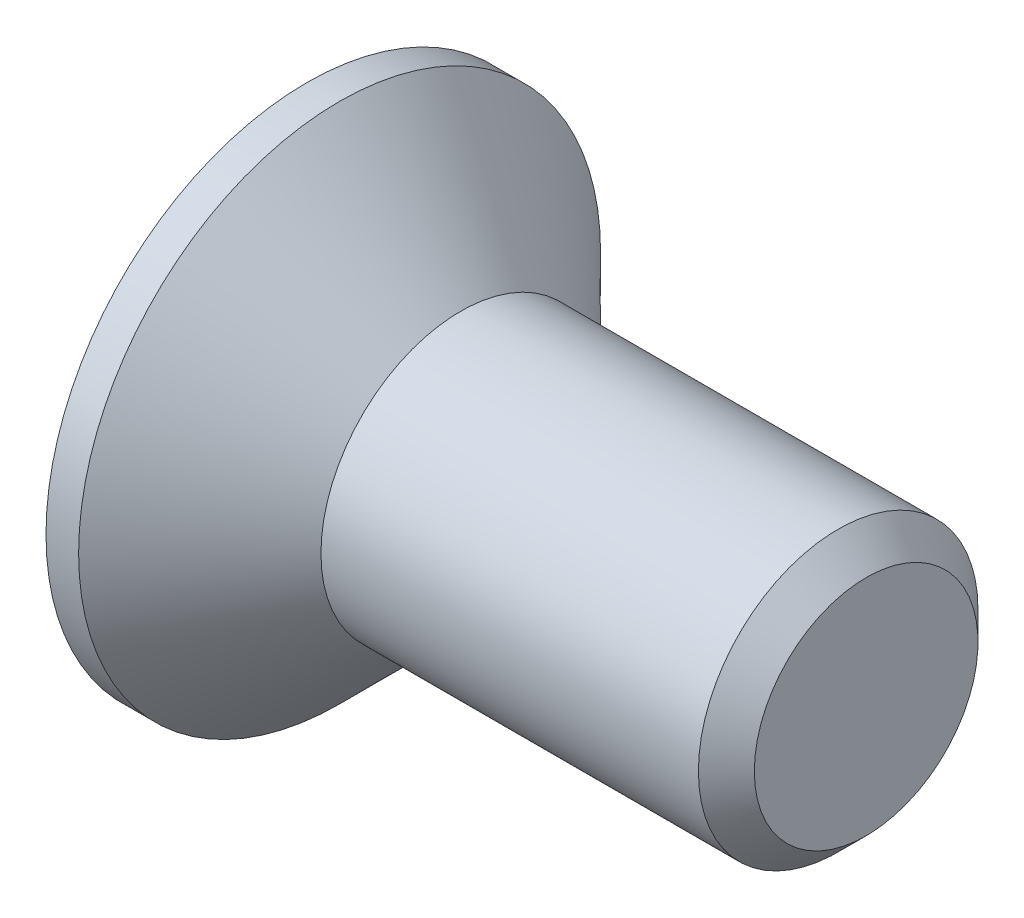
SolidWorks part; units mm, degrees
ref_plane "Front Plane" through (0, 0, 0) normal (0, 0, 1) x (1, 0, 0)
ref_plane "Top Plane" through (0, 0, 0) normal (0, 1, 0) x (1, 0, 0)
ref_plane "Right Plane" through (0, 0, 0) normal (1, 0, 0) x (0, 0, -1)
sketch "Sketch1" plane through (0, 0, 0) normal (0, 0, 1) x (1, 0, 0)
  line L1 (-1.65, 2.8) -> (-1.65, 0)
  line L2 (-1.65, 0) -> (4.35, 0)
  line L3 (4.35, 0) -> (4.35, 1.5)
  line L4 (4.35, 1.5) -> (0, 1.5)
  line L5 (-1.65, 2.8) -> (-1.3, 2.8)
  line L6 (-1.3, 2.8) -> (0, 1.5)
  dimension "D1" = 1.5
  dimension "D2" = 45
  dimension "D3" = 1.65
  dimension "D4" = 6
  dimension "D5" = 2.8
revolve "Revolve1" add sketch "Sketch1" angle 360 about L2
chamfer "Chamfer1" distance 0.3 angle 45 1 edges at (4.35, 0, 1.5)
sketch "Sketch2" plane through (-1.65, 0, 0) normal (-1, 0, 0) x (0, 0, 1)
  line L0 (-0.365, 1.45) -> (0.365, 1.45)
  line L1 (0.365, 1.45) -> (0.365, 0.365)
  line L2 (0.365, 0.365) -> (1.45, 0.365)
  line L3 (1.45, 0.365) -> (1.45, -0.365)
  line L4 (1.45, -0.365) -> (0.365, -0.365)
  line L5 (0.365, -0.365) -> (0.365, -1.45)
  line L6 (0.365, -1.45) -> (-0.365, -1.45)
  line L7 (-0.365, -1.45) -> (-0.365, -0.365)
  line L8 (-0.365, -0.365) -> (-1.45, -0.365)
  line L9 (-1.45, -0.365) -> (-1.45, 0.365)
  line L10 (-1.45, 0.365) -> (-0.365, 0.365)
  line L11 (-0.365, 0.365) -> (-0.365, 1.45)
  point P2 (0, 1.45)
  point P14 (0, -1.45)
  point P15 (1.45, 0)
  point P16 (-1.45, 0)
  dimension "D1" = 2.9
  dimension "D2" = 0.73
extrude "Cut-Extrude1" cut sketch "Sketch2" against normal blind 1.25
